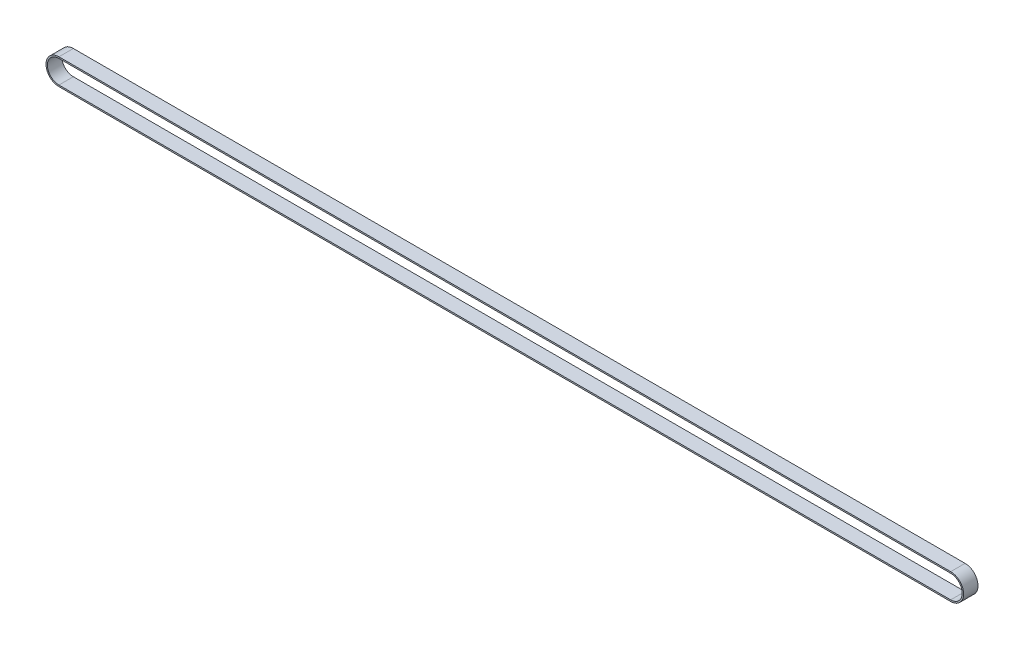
SolidWorks part; units mm, degrees
ref_plane "Plan1" through (0, 0, 0) normal (0, 0, 1) x (1, 0, 0)
ref_plane "Plan2" through (0, 0, 0) normal (0, 1, 0) x (1, 0, 0)
ref_plane "Plan3" through (0, 0, 0) normal (1, 0, 0) x (0, 0, -1)
sketch "Esquisse1" plane through (0, 0, 0) normal (0, 0, 1) x (1, 0, 0)
  line L0 (0, 4) -> (310, 4)
  line L1 (0, -4) -> (310, -4)
  arc A0 (0, 4) -> (0, -4) centre (0, 0) ccw
  arc A1 (310, 4) -> (310, -4) centre (310, 0) cw
  dimension "D2" = 4
  dimension "D1" = 310
extrude "Extru.-Mince1" add sketch "Esquisse1" along normal blind 5 thin
